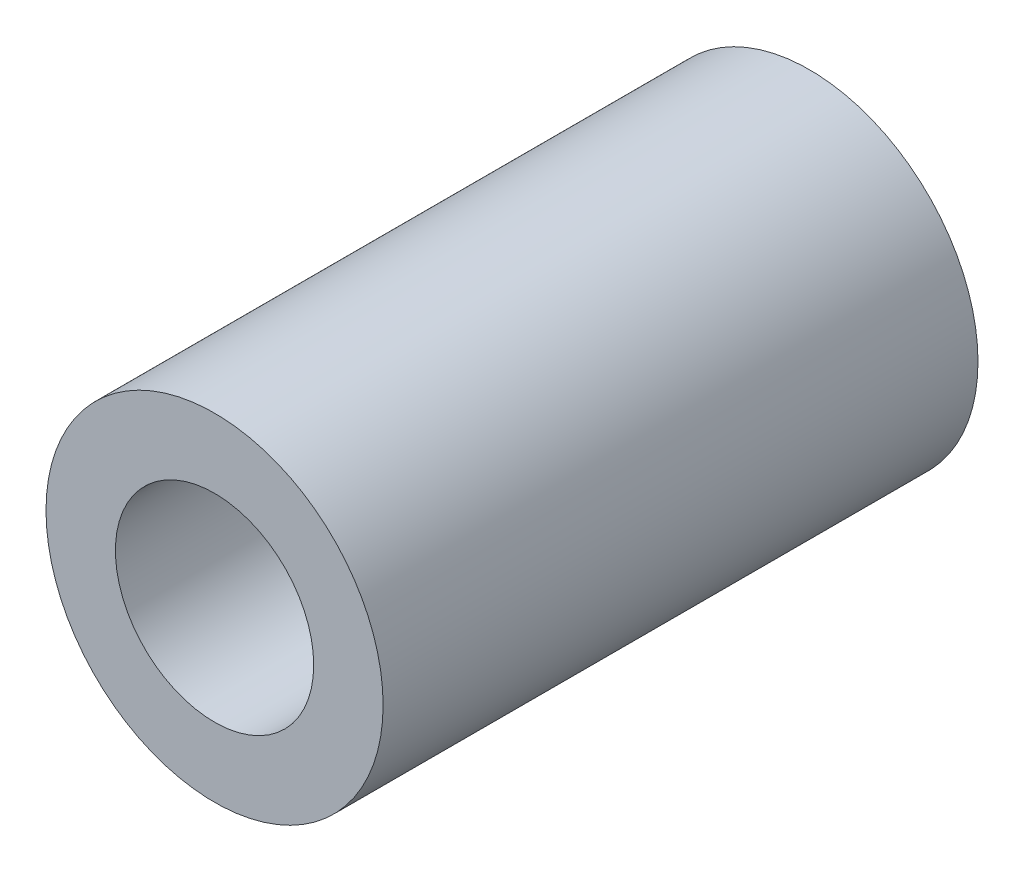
SolidWorks part; units mm, degrees
ref_plane "Plan de face" through (0, 0, 0) normal (0, 0, 1) x (1, 0, 0)
ref_plane "Plan de dessus" through (0, 0, 0) normal (0, 1, 0) x (1, 0, 0)
ref_plane "Plan de droite" through (0, 0, 0) normal (1, 0, 0) x (0, 0, -1)
sketch "Esquisse1" plane through (0, 0, 0) normal (0, 0, 1) x (1, 0, 0)
  circle A0 centre (0, 0) radius 8.5
  circle A1 centre (0, 0) radius 5
  dimension "D2" = 10
  dimension "D1" = 17
extrude "Extrusion1" add sketch "Esquisse1" along normal blind 30
